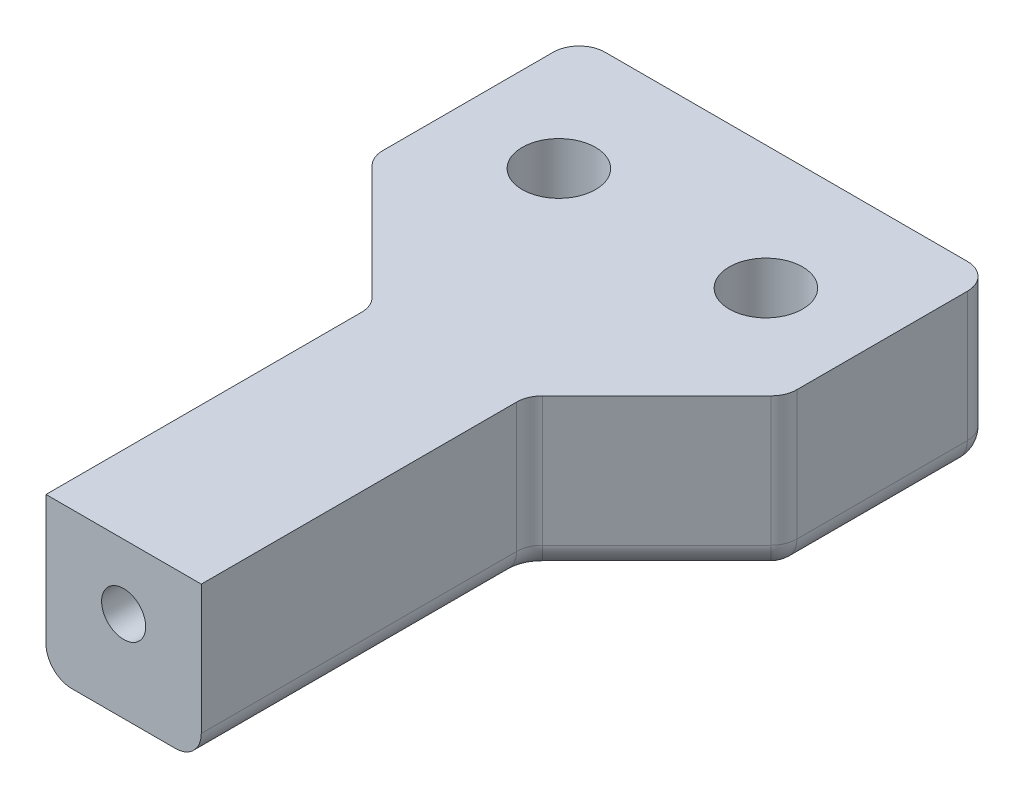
SolidWorks part; units mm, degrees
ref_plane "Front Plane" through (0, 0, 0) normal (0, 0, 1) x (1, 0, 0)
ref_plane "Top Plane" through (0, 0, 0) normal (0, 1, 0) x (1, 0, 0)
ref_plane "Right Plane" through (0, 0, 0) normal (1, 0, 0) x (0, 0, -1)
sketch "Sketch1" plane through (0, 0, 0) normal (0, 1, 0) x (1, 0, 0)
  line L0 (-12.7, -50.8) -> (12.7, -50.8)
  line L1 (12.7, -50.8) -> (12.7, -63.5)
  line L2 (12.7, -63.5) -> (4.7625, -63.5)
  line L3 (4.7625, -63.5) -> (4.7625, -91.44)
  line L4 (4.7625, -91.44) -> (-4.7625, -91.44)
  line L5 (-4.7625, -91.44) -> (-4.7625, -63.5)
  line L6 (-4.7625, -63.5) -> (-12.7, -63.5)
  line L7 (-12.7, -63.5) -> (-12.7, -50.8)
  line L8 (0, 0) -> (0, -91.44) construction
  line L9 (4.7625, -91.44) -> (-4.7625, -91.44) construction
  point P13 (0, -50.8)
  dimension "D1" = 50.8
  dimension "D3" = 9.525
  dimension "D5" = 25.4
  dimension "D6" = 12.7
  dimension "D7" = 12.7
extrude "Boss-Extrude1" add sketch "Sketch1" along normal blind 9.525
chamfer "Chamfer1" distance 7.9375 angle 45 2 edges at (4.7625, 4.7625, 63.5) (-4.7625, 4.7625, 63.5)
fillet "Fillet2" radius 1.5875 13 edges at (-4.7625, 4.7625, 71.4375) (4.7625, 4.7625, 71.4375) (12.7, 4.7625, 63.5) (-12.7, 4.7625, 63.5) (12.7, 4.7625, 50.8) (-12.7, 4.7625, 50.8) (-12.7, 0, 57.15) (0, 0, 50.8) (12.7, 0, 57.15) (-8.7312, 0, 67.4688) (8.7313, 0, 67.4688) (4.7625, 0, 81.4387) (-4.7625, 0, 81.4387)
sketch "Sketch2" plane through (0, 0, 0) normal (0, 1, 0) x (1, 0, 0)
  line L1 (-6.35, -54.5911) -> (-6.35, -62.1954) construction
  line L2 (6.35, -54.5911) -> (6.35, -62.1954) construction
  circle A0 centre (0, 0) radius 58.7375 construction
  point P8 (-6.35, -58.3932)
  point P9 (6.35, -58.3932)
  dimension "D1" = 117.475
  dimension "D2" = 7.6042
  dimension "D3" = 12.7
hole_wizard "CBORE for #8 Socket Head Cap Screw1" positions "Sketch8" profile "Sketch7" counterbore size "#8" standard "ANSI Inch"
sketch "Sketch8" plane through (0, 0, 0) normal (0, -1, 0) x (-1, 0, 0)
  line L0 (6.35, -54.5911) -> (6.35, -62.1954) construction
  line L1 (-6.35, -54.5911) -> (-6.35, -62.1954) construction
  point P0 (6.35, -58.3932)
  point P4 (-6.35, -58.3932)
sketch "Sketch7" plane through (-6.35, 0, 58.3932) normal (1, 0, 0) x (0, 0, -1)
  line L0 (0, 0) -> (0, 9.525)
  line L1 (0, 9.525) -> (2.2479, 9.525)
  line L3 (2.2479, 9.525) -> (2.2479, 4.1656)
  line L4 (2.2479, 4.1656) -> (3.9687, 4.1656)
  line L5 (3.9687, 4.1656) -> (3.9687, 0)
  line L7 (3.9687, 0) -> (0, 0)
  line L11 (0, -6.35) -> (0, 107.95) construction
  dimension "Thru Hole Dia." = 4.4958
  dimension "Thru Hole Depth" = 9.525
  dimension "C'Bore Dia." = 7.9375
  dimension "C'Bore Depth" = 4.1656
hole_wizard "#6-32 Tapped Hole1" positions "Sketch10" profile "Sketch9" tap size "#6-32" standard "ANSI Inch"
sketch "Sketch10" plane through (0, 0, 91.44) normal (0, 0, 1) x (1, 0, 0)
  line L2 (-4.7625, 9.525) -> (-4.7625, 1.5875) construction
  point P0 (0, 5.5563)
  point P9 (-4.7625, 5.5563)
sketch "Sketch9" plane through (0, 5.5563, 91.44) normal (1, 0, 0) x (0, -1, 0)
  line L0 (0, 0) -> (0, 14.7827)
  line L1 (0, 14.7827) -> (1.3525, 13.97)
  line L2 (1.3525, 13.97) -> (1.3525, 0)
  line L5 (1.3525, 0) -> (0, 0)
  line L10 (0, 14.7827) -> (-1.3526, 13.97) construction
  line L11 (0, -6.35) -> (0, 107.95) construction
  dimension "Tap Drill Dia." = 2.7051
  dimension "Tap Drill Depth" = 13.97
  dimension "Drill Angle" = 118
sketch "Sketch11" plane through (0, 0, 91.44) normal (0, 0, 1) x (1, 0, 0)
  line L0 (0, 0) -> (0, 9.525) construction
  line L1 (-4.7625, 9.525) -> (4.7625, 9.525) construction
